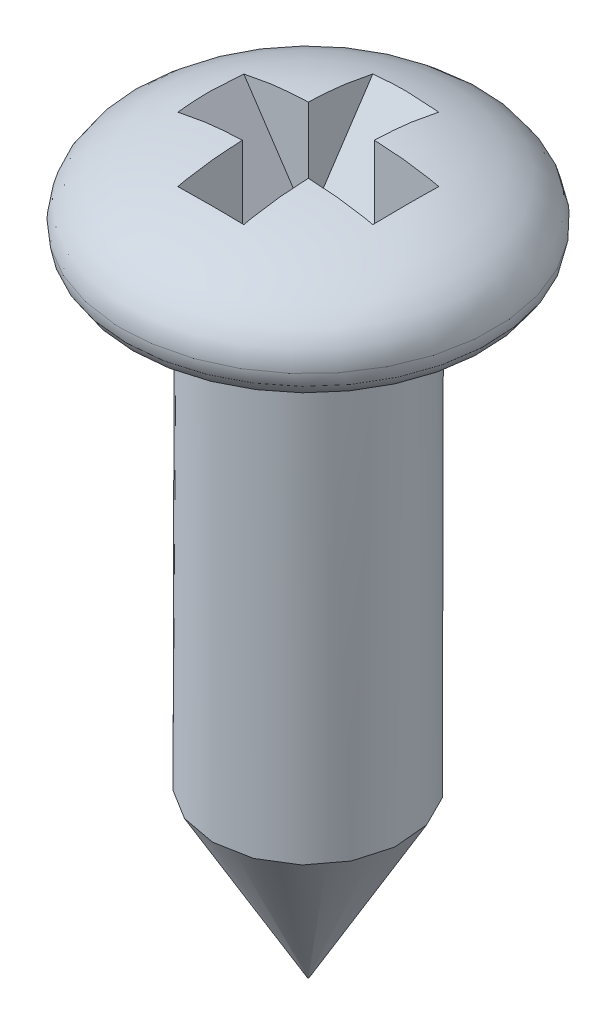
SolidWorks part; units mm, degrees
ref_plane "Plan de face" through (0, 0, 0) normal (0, 0, 1) x (1, 0, 0)
ref_plane "Plan de dessus" through (0, 0, 0) normal (0, 1, 0) x (1, 0, 0)
ref_plane "Plan de droite" through (0, 0, 0) normal (1, 0, 0) x (0, 0, -1)
sketch "Esquisse1" plane through (0, 0, 0) normal (0, 1, 0) x (1, 0, 0)
  circle A0 centre (0, 0) radius 1.45
extrude "Extrusion1" add sketch "Esquisse1" along normal blind 9.4
sketch "Esquisse2" plane through (0, 0, 0) normal (0, 0, 1) x (1, 0, 0)
  line L0 (-3.5764, 6.4) -> (3.9855, 6.4) construction
  line L1 (0, 8.9067) -> (0, 4.7448) construction
  line L2 (-2.6992, 11) -> (4.0303, 11) construction
  line L3 (-2.8, 8.6386) -> (-2.8, 5.3938) construction
  line L4 (0, 9.4) -> (-2.3, 9.4)
  line L5 (0, 11) -> (0, 9.4)
  arc A0 (-2.3, 9.4) -> (-2.8, 9.9001) centre (-2.3, 9.9) cw
  spline S0 degree 3 poles (-2.8, 9.9001) (-2.802, 10.3106) (-1.7042, 10.9956) (-0.6729, 10.9983) (0, 11) knots 0 0 0 0 0.347597 1 1 1 1
  point P15 (-2.8, 6.4)
  point P18 (-2.8, 8)
  point P21 (0, 6.4)
  dimension "D1" = 0.5
revolve "Révolution1" add sketch "Esquisse2" angle 360 about L1
sketch "Esquisse3" plane through (0, 0, 0) normal (0, 0, 1) x (1, 0, 0)
  line L0 (0, 9.9885) -> (0, 5.1977) construction
  line L1 (-3.3122, 9.4) -> (4.0377, 9.4) construction
  line L2 (-3.6691, 0) -> (6.2564, 0) construction
  line L3 (-1.5, 11.9361) -> (-1.5, 8.7428) construction
  line L4 (-0.5, 10.218) -> (-0.5, 8.7428) construction
  line L5 (0, 11.589) -> (-1.5, 11.3981)
  line L6 (-2.5295, 10.9) -> (1.4809, 10.9) construction
  line L7 (-1.5, 11.3981) -> (-1.5, 10.9)
  line L8 (-1.5, 10.9) -> (-0.5, 9.4)
  line L9 (-0.5, 9.4) -> (0.5, 9.4)
  line L10 (1.5, 10.9) -> (0.5, 9.4)
  line L11 (1.5, 11.3981) -> (1.5, 10.9)
  line L12 (0, 11.589) -> (1.5, 11.3981)
  point P19 (0, 9.4)
extrude "Enlèv. mat.-Extru.1" cut sketch "Esquisse3" against normal mid plane 1
pattern_circular "Répétition circulaire1" count 2 every 90 about axis through (0, 0, 0) along (0, 1, 0) of "Enlèv. mat.-Extru.1"
chamfer "Chanfrein1" distance 1.44 distance2 2.5 1 edges at (0, 0, 1.45)
